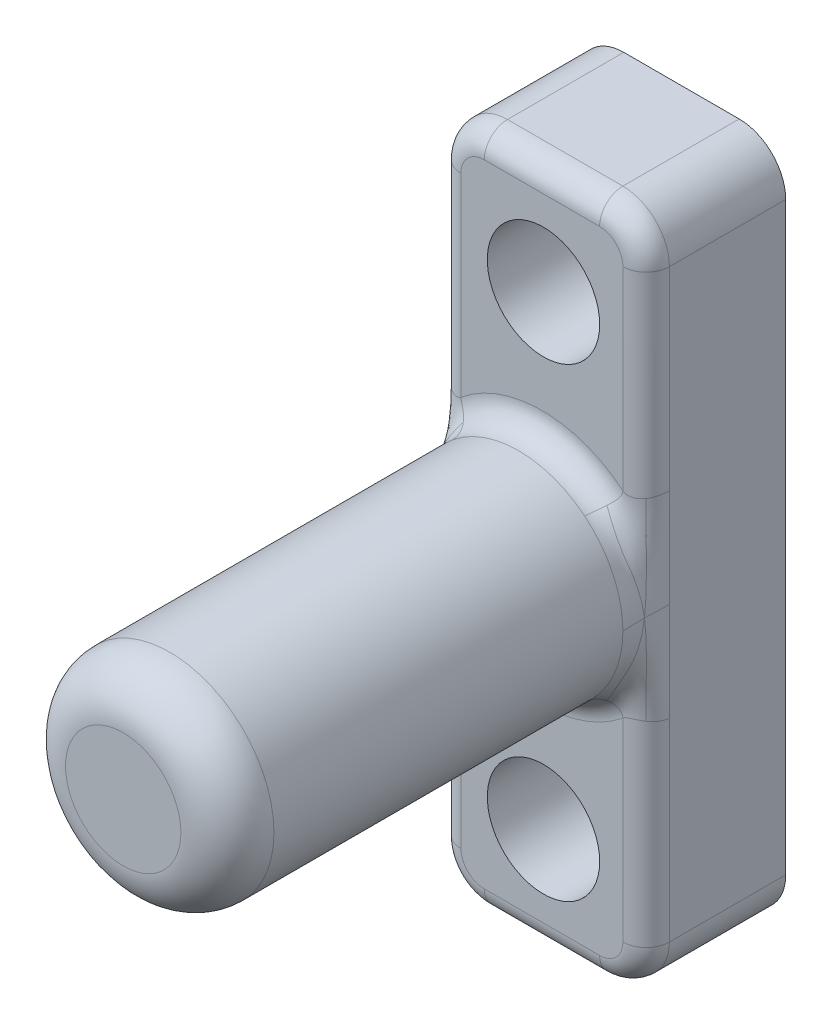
SolidWorks part; units mm, degrees
ref_plane "Front Plane" through (0, 0, 0) normal (0, 0, 1) x (1, 0, 0)
ref_plane "Top Plane" through (0, 0, 0) normal (0, 1, 0) x (1, 0, 0)
ref_plane "Right Plane" through (0, 0, 0) normal (1, 0, 0) x (0, 0, -1)
sketch "Sketch1" plane through (0, 0, 0) normal (0, 0, 1) x (1, 0, 0)
  line L16 (0.0419, 9.5085) -> (-9.3608, 9.5085) construction
  line L47 (-5.7329, -6.3576) -> (-5.7329, 25.5747)
  line L48 (-3.1929, -8.8976) -> (3.1064, -8.8976)
  line L49 (5.6464, -6.3576) -> (5.6464, 25.5747)
  line L50 (-3.1929, 28.1147) -> (3.1064, 28.1147)
  circle A4 centre (0.0419, -3.1915) radius 3.0677
  circle A5 centre (0.0419, 22.2085) radius 3.0677
  arc A6 (-5.7329, -6.3576) -> (-3.1929, -8.8976) centre (-3.1929, -6.3576) ccw
  arc A7 (3.1064, -8.8976) -> (5.6464, -6.3576) centre (3.1064, -6.3576) ccw
  arc A8 (5.6464, 25.5747) -> (3.1064, 28.1147) centre (3.1064, 25.5747) ccw
  arc A9 (-5.7329, 25.5747) -> (-3.1929, 28.1147) centre (-3.1929, 25.5747) cw
  dimension "D1" = 2.54
extrude "Boss-Extrude1" add sketch "Sketch1" along normal blind 7.62
sketch "Sketch2" plane through (0, 0, 7.62) normal (0, 0, 1) x (1, 0, 0)
  line L0 (-5.7329, 9.6086) -> (5.6464, 9.6086) construction
  line L1 (-5.7329, 25.5747) -> (-5.7329, -6.3576) construction
  line L2 (5.6464, -6.3576) -> (5.6464, 25.5747) construction
  circle A0 centre (-0.0433, 9.6086) radius 5.6896
  circle A1 centre (-0.0433, 9.6086) radius 3.7846
  dimension "D1" = 1.905
extrude "Boss-Extrude2" add sketch "Sketch2" along normal blind 17.78
sketch "Sketch3" plane through (0, 0, 25.4) normal (0, 0, 1) x (1, 0, 0)
  circle A2 centre (-0.0433, 9.6086) radius 5.6896
  circle A3 centre (-0.0433, 9.6086) radius 5.6896
  dimension "D1" = 0
extrude "Boss-Extrude3" add sketch "Sketch3" along normal blind 5.08
fillet "Fillet1" radius 2.54 1 edges at (5.6464, 9.6086, 30.48)
fillet "Fillet2" radius 1.27 12 edges at (4.9024, -8.1536, 7.62) (5.6464, 1.6255, 7.62) (4.9024, 27.3708, 7.62) (-0.0433, 28.1147, 7.62) (-4.9889, 27.3708, 7.62) (-5.7329, 17.5917, 7.62) (5.6464, 17.5917, 7.62) (-5.7329, 1.6255, 7.62) (-0.0433, 3.9189, 7.62) (-0.0433, 15.2982, 7.62) (-4.9889, -8.1536, 7.62) (-0.0433, -8.8976, 7.62)
sketch "Sketch4" plane through (0, 0, 25.4) normal (0, 0, -1) x (-1, 0, 0)
  circle A1 centre (0.0433, 9.6086) radius 3.7846
  circle A2 centre (0.0433, 9.6086) radius 3.7846
  dimension "D1" = 0
extrude "Cut-Extrude1" cut sketch "Sketch4" along normal up to surface (25.4 mm away)
